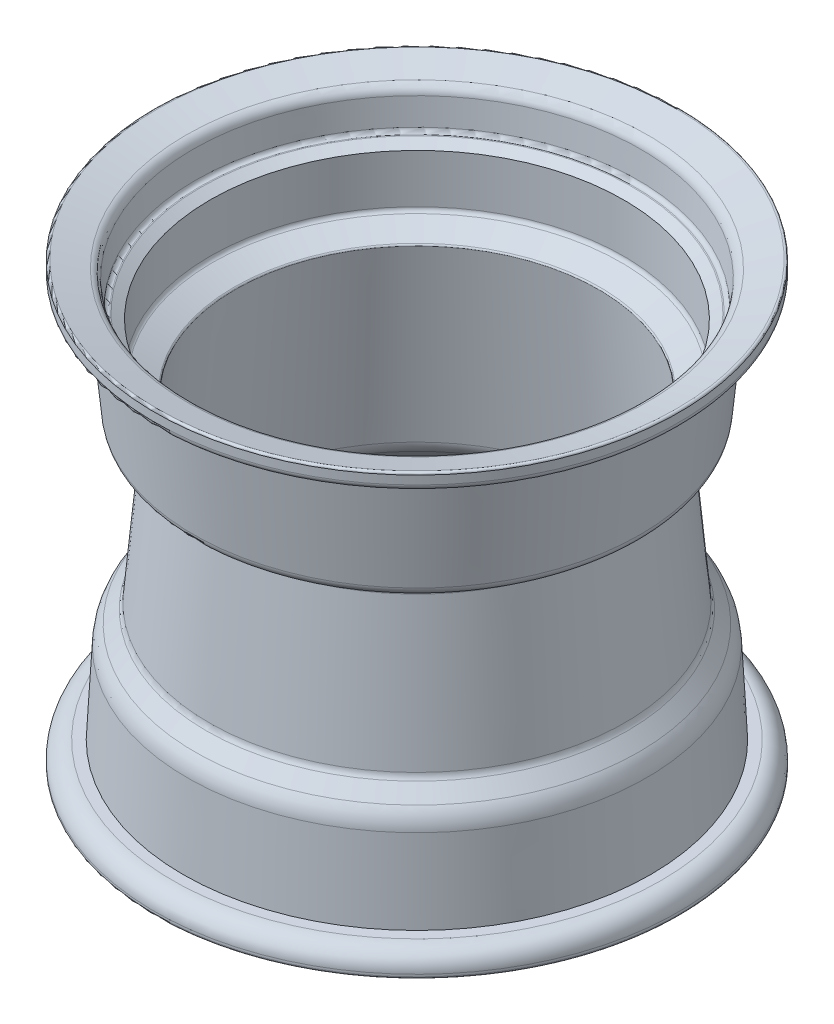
SolidWorks part; units mm, degrees
ref_plane "Front Plane" through (0, 0, 0) normal (0, 0, 1) x (1, 0, 0)
ref_plane "Top Plane" through (0, 0, 0) normal (0, 1, 0) x (1, 0, 0)
ref_plane "Right Plane" through (0, 0, 0) normal (1, 0, 0) x (0, 0, -1)
sketch "Sketch1" plane through (0, 0, 0) normal (0, 0, 1) x (1, 0, 0)
  line L0 (-171.31, 68.8253) -> (-186.6145, -101.8791)
  line L1 (-191.3882, -112.8059) -> (-202.1414, -124.7169)
  line L2 (-206.9642, -136.3337) -> (-211.1103, -215.0216)
  line L3 (-192.5085, 80.4398) -> (-172.2852, 70.456)
  line L4 (-194.9302, 84.3361) -> (-194.9302, 130.2948)
  line L5 (-194.9302, 130.2948) -> (-203.9022, 135.9189)
  line L7 (-210.8758, 163.6866) -> (-208.5702, 139.5677)
  line L8 (-244.6723, 179.5717) -> (-217.6503, 171.8346)
  line L9 (-247.0714, 177.7631) -> (-247.0714, 169.7008)
  line L10 (-242.7892, 164.2237) -> (-226.2917, 160.1223)
  line L11 (-219.1973, 151.8889) -> (-210.3795, 59.6441)
  line L12 (-204.7292, 51.8968) -> (-189.3691, 45.2969)
  line L13 (-183.7138, 35.8145) -> (-195.9834, -101.0392)
  line L14 (-198.3702, -106.5026) -> (-209.1235, -118.4135)
  line L15 (-216.3576, -135.8388) -> (-220.4098, -212.7443)
  line L16 (-220.4098, -212.7443) -> (-230.1399, -212.7443)
  line L17 (-247.0714, -229.6759) -> (-247.0714, -231.7431)
  line L18 (-239.5463, -233.6244) -> (-245.1902, -233.6244)
  line L19 (-237.665, -229.6759) -> (-237.665, -231.7431)
  line L20 (-218.625, -222.1508) -> (-230.1399, -222.1508)
  line L21 (0, 224.3656) -> (0, -303.1183) construction
  arc A0 (-191.3882, -112.8059) -> (-186.6145, -101.8791) centre (-205.3522, -100.1992) ccw
  arc A1 (-202.1414, -124.7169) -> (-206.9642, -136.3337) centre (-188.1774, -137.3236) ccw
  arc A2 (-171.31, 68.8253) -> (-172.2852, 70.456) centre (-173.1912, 68.8072) ccw
  arc A3 (-194.9302, 84.3361) -> (-192.5085, 80.4398) centre (-190.585, 84.3361) ccw
  arc A4 (-208.5702, 139.5677) -> (-204.7749, 136.1635) centre (-204.8247, 139.9258) ccw
  arc A5 (-210.8758, 163.6866) -> (-217.6503, 171.8346) centre (-220.2395, 162.7915) ccw
  arc A6 (-244.6723, 179.5717) -> (-247.0714, 177.7631) centre (-245.1902, 177.7631) ccw
  arc A7 (-247.0714, 169.7008) -> (-242.7892, 164.2237) centre (-241.4276, 169.7008) ccw
  arc A8 (-219.1973, 151.8889) -> (-226.2917, 160.1223) centre (-228.5611, 150.9938) ccw
  arc A9 (-210.3795, 59.6441) -> (-204.7292, 51.8968) centre (-201.0157, 60.5392) ccw
  arc A10 (-183.7138, 35.8145) -> (-189.3691, 45.2969) centre (-193.0826, 36.6545) ccw
  arc A11 (-198.3702, -106.5026) -> (-195.9834, -101.0392) centre (-205.3522, -100.1992) ccw
  arc A12 (-209.1235, -118.4135) -> (-216.3576, -135.8388) centre (-188.1774, -137.3236) ccw
  arc A13 (-230.1399, -212.7443) -> (-247.0714, -229.6759) centre (-230.1399, -229.6759) ccw
  arc A14 (-247.0714, -231.7431) -> (-245.1902, -233.6244) centre (-245.1902, -231.7431) ccw
  arc A15 (-239.5463, -233.6244) -> (-237.665, -231.7431) centre (-239.5463, -231.7431) ccw
  arc A16 (-230.1399, -222.1508) -> (-237.665, -229.6759) centre (-230.1399, -229.6759) ccw
  arc A17 (-218.625, -222.1508) -> (-211.1103, -215.0216) centre (-218.625, -214.6256) ccw
  arc A18 (-204.7749, 136.1635) -> (-203.9022, 135.9189) centre (-204.7537, 134.5606) cw
  dimension "D3" = 9.4064
  dimension "D4" = 7.9331
  dimension "D5" = 23.8847
  dimension "D6" = 35.8145
  dimension "D7" = 45.2969
  dimension "D8" = 108.129
  dimension "D9" = 5.123
  dimension "D10" = 101.0392
  dimension "D12" = 150.9938
  dimension "D14" = 109.421
  dimension "D16" = 5.6439
  dimension "D17" = 1.8813
  dimension "D18" = 18.7071
  dimension "D19" = 12.8665
  dimension "D20" = 8.0623
  dimension "D23" = 18.8129
  dimension "D24" = 28.2193
  dimension "D25" = 16.9316
  dimension "D26" = 7.5251
  dimension "D27" = 1.8813
  dimension "D29" = 100.1992
  dimension "D1" = 36.6545
  dimension "D2" = 193.0826
  dimension "D11" = 118.713
  dimension "D13" = 228.5611
  dimension "D15" = 160.1223
  dimension "D21" = 74.022
  dimension "D22" = 28.1079
  dimension "D28" = 143.047
other "AlignGroup1"
other "AlignGroup2"
revolve "Revolve1" add sketch "Sketch1" angle 360 about L21
